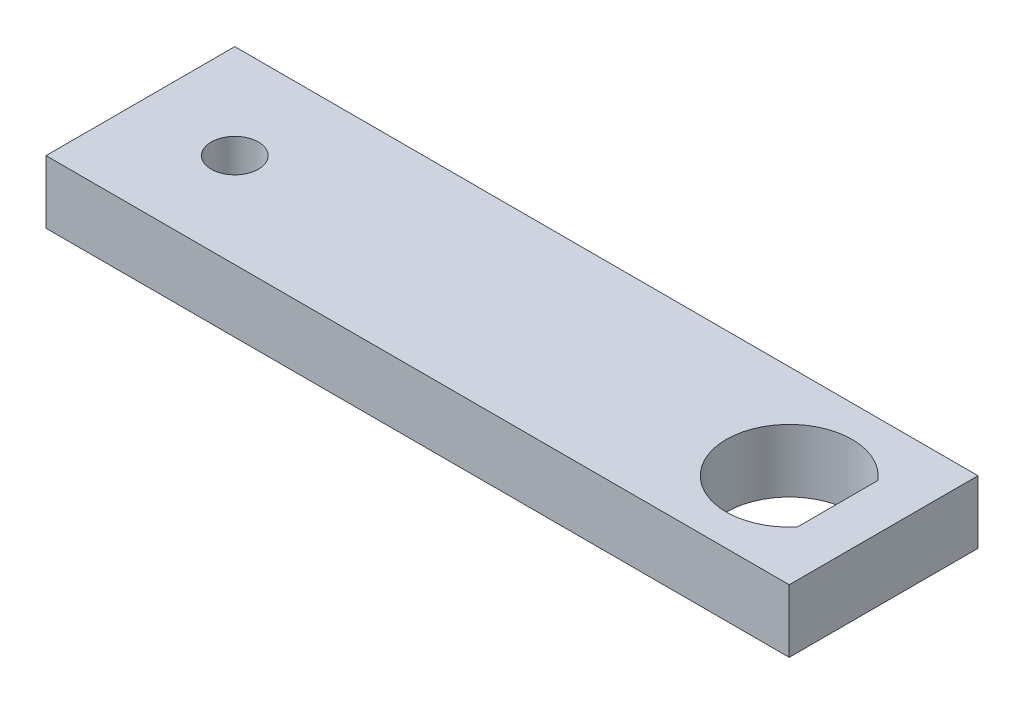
SolidWorks part; units mm, degrees
extrude "Base-Extrude" add sketch "Sketch1" along normal blind 19.05
sketch "Sketch1" plane through (0, 0, 0) normal (0, 0, 1) x (1, 0, 0)
  line L0 (0, 0) -> (75, 0)
  line L1 (0, 0) -> (0, 6.35)
  line L2 (75, 6.35) -> (0, 6.35)
  line L3 (75, 6.35) -> (75, 0)
  dimension "D1" = 6.35
  dimension "D2" = 75
extrude "Cut-Extrude1" cut sketch "Sketch2" against normal through all
sketch "Sketch2" plane through (0, 6.35, 0) normal (0, 1, 0) x (-1, 0, 0)
  line L0 (-75, 19.05) -> (-75, 0) construction
  line L1 (-75, 19.05) -> (0, 19.05) construction
  line L2 (-70.3645, 5.4734) -> (-70.3645, 13.5766)
  arc A0 (-70.3645, 5.4734) -> (-70.3645, 13.5766) centre (-65.475, 9.525) ccw
  dimension "D1" = 12.7
  dimension "D2" = 9.525
  dimension "D3" = 9.525
  dimension "D4" = 4.8895
extrude "Cut-Extrude2" cut sketch "Sketch3" against normal through all
sketch "Sketch3" plane through (0, 6.35, 0) normal (0, 1, 0) x (-1, 0, 0)
  line L0 (0, 19.05) -> (0, 0) construction
  circle A0 centre (-9.525, 9.525) radius 2.3813
  arc A1 (-70.3645, 5.4734) -> (-70.3645, 13.5766) centre (-65.475, 9.525) ccw construction
  point P5 (-65.475, 9.525)
  dimension "D1" = 4.7625
  dimension "D2" = 9.525
ref_plane "Front" through (0, 0, 0) normal (0, 0, 1) x (1, 0, 0)
ref_plane "Top" through (0, 0, 0) normal (0, 1, 0) x (-1, 0, 0)
ref_plane "Right" through (0, 0, 0) normal (1, 0, 0) x (0, 0, -1)
